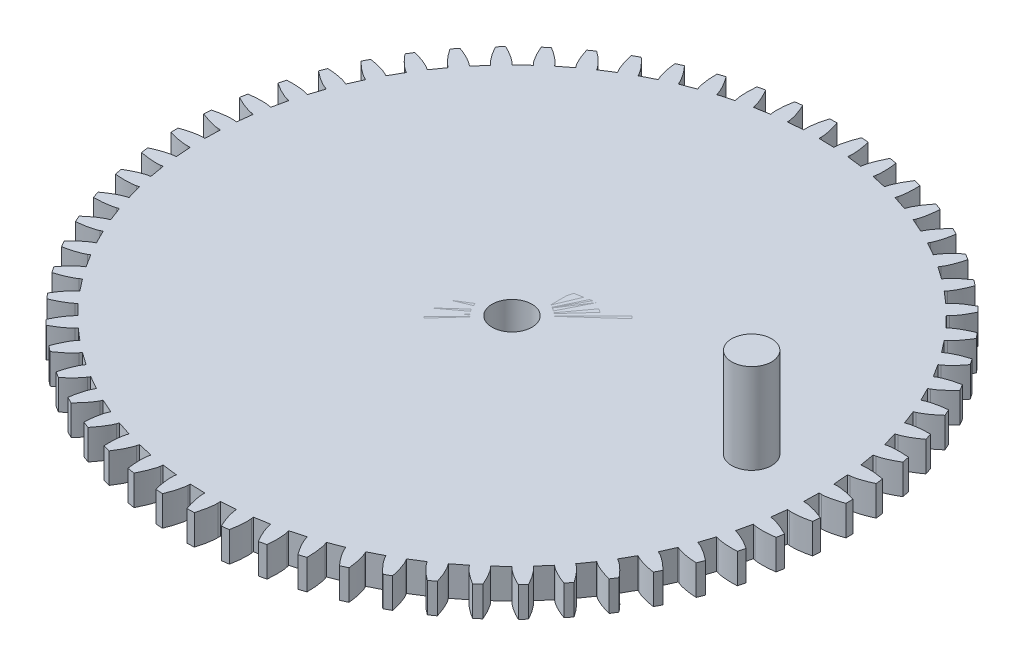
SolidWorks part; units mm, degrees
ref_plane "Front Plane" through (0, 0, 0) normal (0, 0, 1) x (1, 0, 0)
ref_plane "Top Plane" through (0, 0, 0) normal (0, 1, 0) x (1, 0, 0)
ref_plane "Right Plane" through (0, 0, 0) normal (1, 0, 0) x (0, 0, -1)
sketch "Sketch1" plane through (0, 0, 0) normal (0, 1, 0) x (1, 0, 0)
  line L0 (0, 0) -> (0, 15.4904) construction
  line L1 (0, 0) -> (-15.4904, 0) construction
  line L2 (0, 0) -> (-16.495, -0.4049) construction
  line L3 (0, 0) -> (-15.4717, -0.7601) construction
  line L4 (0, 0) -> (-15.4158, -1.5183) construction
  circle A0 centre (0, 0) radius 16 construction
  circle A1 centre (0, 0) radius 15.4904 construction
  circle A2 centre (0, 0) radius 15.375 construction
  circle A3 centre (0, 0) radius 16.5 construction
  spline S0 degree 4 poles (-15.4904, 0) (-15.5169, 0) (-15.5911, -0.0027) (-15.731, -0.0186) (-15.9571, -0.0597) (-16.2409, -0.1342) (-16.6008, -0.2552) (-17.0142, -0.4291) (-17.4552, -0.6523) (-17.9184, -0.9284) (-18.3641, -1.2326) (-18.7919, -1.5613) (-19.2022, -1.9118) (-19.6787, -2.3607) (-20.2209, -2.9349) (-20.8083, -3.6496) (-21.4174, -4.5168) (-21.9725, -5.443) (-22.4637, -6.4037) (-22.8391, -7.271) (-23.1228, -8.0279) (-23.3345, -8.6697) (-23.489, -9.1835) (-23.6643, -9.8404) (-23.8152, -10.487) (-23.9435, -11.1652) (-24.0686, -11.9401) (-24.1523, -12.6533) (-24.2099, -13.2503) (-24.2505, -14.0054) (-24.264, -14.391) (-24.2729, -14.9355) (-24.2689, -15.3393) (-24.2617, -15.7064) (-24.2528, -15.9118) (-24.2482, -16.0316) knots 0 0 0 0 0 0.005377 0.015084 0.028532 0.04661 0.064855 0.092111 0.119476 0.146842 0.174209 0.201575 0.228941 0.256307 0.307035 0.361767 0.4165 0.471232 0.525964 0.580697 0.608063 0.635429 0.662795 0.690161 0.744894 0.77226 0.799626 0.854358 0.881725 0.909091 0.931818 0.954545 0.977273 1 1 1 1 1 construction
  spline S1 degree 4 poles (-15.4904, 0) (-15.5169, 0) (-15.5911, -0.0027) (-15.731, -0.0186) (-15.9571, -0.0597) (-16.2409, -0.1342) (-16.6008, -0.2552) (-17.0142, -0.4291) (-17.4552, -0.6523) (-17.9184, -0.9284) (-18.3641, -1.2326) (-18.7919, -1.5613) (-19.2022, -1.9118) (-19.6787, -2.3607) (-20.2209, -2.9349) (-20.8083, -3.6496) (-21.4174, -4.5168) (-21.9725, -5.443) (-22.4637, -6.4037) (-22.8391, -7.271) (-23.1228, -8.0279) (-23.3345, -8.6697) (-23.489, -9.1835) (-23.6643, -9.8404) (-23.8152, -10.487) (-23.9435, -11.1652) (-24.0686, -11.9401) (-24.1523, -12.6533) (-24.2099, -13.2503) (-24.2435, -13.8756) (-24.2537, -14.1161) (-24.2578, -14.2386) knots 0 0 0 0 0 0.005377 0.015084 0.028532 0.04661 0.064855 0.092111 0.119476 0.146842 0.174209 0.201575 0.228941 0.256307 0.307035 0.361767 0.4165 0.471232 0.525964 0.580697 0.608063 0.635429 0.662795 0.690161 0.744894 0.77226 0.799626 0.854358 0.881725 0.909091 0.909091 0.909091 0.909091 0.909091
  dimension "D1" = 33
  dimension "D2" = 32
  dimension "D3" = 30.9807
  dimension "D4" = 30.75
  dimension "D5" = 15.4904
  dimension "D6" = 1.406
  dimension "D7" = 2.813
  dimension "D8" = 5.625
sketch "Sketch2" plane through (0, 0, 0) normal (0, 1, 0) x (1, 0, 0)
  line L0 (0, 0) -> (-16.495, -0.4049) construction
  line L1 (0, 0) -> (-16.495, -0.4049) construction
  line L2 (0, 0) -> (-15.4717, -0.7601) construction
  line L3 (0, 0) -> (-15.4904, 0) construction
  line L4 (0, 0) -> (-15.4158, -1.5183) construction
  line L5 (0, 0) -> (-15.4717, -0.7601) construction
  line L6 (0, 0) -> (-15.4904, 0) construction
  line L7 (0, 0) -> (-15.4158, -1.5183) construction
  line L8 (-15.4717, -0.7601) -> (-15.3565, -0.7544)
  line L9 (-15.3565, -0.7544) -> (-15.301, -1.507)
  line L10 (-15.301, -1.507) -> (-15.4158, -1.5183) construction
  line L11 (-15.301, -1.507) -> (-0.9952, -0.098)
  line L12 (-15.4904, 0) -> (-1, 0)
  circle A0 centre (0, 0) radius 15.375 construction
  circle A1 centre (0, 0) radius 15.4904 construction
  circle A2 centre (0, 0) radius 16 construction
  circle A3 centre (0, 0) radius 16.5 construction
  circle A4 centre (0, 0) radius 15.375 construction
  circle A5 centre (0, 0) radius 15.4904 construction
  circle A6 centre (0, 0) radius 16 construction
  circle A7 centre (0, 0) radius 16.5 construction
  arc A8 (-16.4896, -0.5857) -> (-16.4985, -0.2241) centre (0, 0) cw
  circle A11 centre (0, 0) radius 1 construction
  arc A12 (-1, 0) -> (-0.9952, -0.098) centre (0, 0) ccw
  spline S0 degree 4 poles (-74.7598, -1998.8887) (-11.1782, -43.2906) (-12.0624, -0.9289) (-14.0898, 0.2799) (-15.9571, -0.0597) (-16.2409, -0.1342) (-16.6008, -0.2552) (-17.0142, -0.4291) (-17.4552, -0.6523) (-17.9184, -0.9284) (-18.3641, -1.2326) (-18.7919, -1.5613) (-19.2022, -1.9118) (-19.6787, -2.3607) (-20.2209, -2.9349) (-20.8083, -3.6496) (-21.4174, -4.5168) (-21.9725, -5.443) (-22.4637, -6.4037) (-22.8391, -7.271) (-23.1228, -8.0279) (-23.3345, -8.6697) (-23.489, -9.1835) (-23.6643, -9.8404) (-23.8152, -10.487) (-23.9435, -11.1652) (-24.0686, -11.9401) (-24.1523, -12.6533) (-24.3829, -15.0417) (-24.3201, -20.6423) (-21.8513, 38.624) (-89.4077, -2013.0629) knots -0.338384 -0.338384 -0.338384 -0.338384 -0.338384 0.005377 0.015084 0.028532 0.04661 0.064855 0.092111 0.119476 0.146842 0.174209 0.201575 0.228941 0.256307 0.307035 0.361767 0.4165 0.471232 0.525964 0.580697 0.608063 0.635429 0.662795 0.690161 0.744894 0.77226 0.799626 0.854358 0.881725 1.319658 1.319658 1.319658 1.319658 1.319658 only from (-15.4904, 0) to (-24.2578, -14.2386) construction
  spline S1 degree 4 poles (-15.4904, 0) (-15.5169, 0) (-15.5911, -0.0027) (-15.731, -0.0186) (-15.9571, -0.0597) (-16.1824, -0.1188) (-16.3587, -0.1749) (-16.4707, -0.2141) (-16.4985, -0.2241) knots 0 0 0 0 0 0.005377 0.015084 0.028532 0.04661 0.05261 0.05261 0.05261 0.05261 0.05261
  spline S2 degree 4 poles (-15.4717, -0.7601) (-15.4982, -0.7614) (-15.5725, -0.7623) (-15.713, -0.7533) (-15.9408, -0.7233) (-16.1688, -0.6753) (-16.3476, -0.628) (-16.4613, -0.5943) (-16.4896, -0.5857) knots 0 0 0 0 0 0.005377 0.015084 0.028532 0.04661 0.05261 0.05261 0.05261 0.05261 0.05261
  point P21 (-15.3565, -0.7544)
  point P24 (-15.301, -1.507)
  dimension "D2" = 2
extrude "Boss-Extrude1" add sketch "Sketch2" along normal blind 1.5
pattern_circular "CirPattern1" count 64 over 360 of "Boss-Extrude1"
sketch "Sketch5" plane through (0, 1.5, 0) normal (0, 1, 0) x (1, 0, 0)
  line L0 (0, 0) -> (12, 0) construction
  circle A0 centre (12, 0) radius 1
  dimension "D1" = 2
  dimension "D2" = 12
extrude "Boss-Extrude2" add sketch "Sketch5" along normal blind 4.5 contours A0
equation "\"Module\"= .5"
equation "\"Number of Teeth\"= 64"
equation "\"Pressure Angle\"= 14.5deg"
equation "\"Pitch Diameter\"= \"Number of Teeth\" * \"Module\""
equation "\"Circular Pitch\"= pi * \"Module\""
equation "\"Addendum\"= \"Module\""
equation "\"Dedendum\"= 1.25 * \"Module\""
equation "\"Base Diameter\"= \"Pitch Diameter\" * cos ( \"Pressure Angle\" )"
equation "\"Base Radius\"= \"Base Diameter\" / 2"
equation "\"Width\"= 1.5"
equation "\"Outside Diameter\"= \"Pitch Diameter\" + 2 * \"Addendum\""
equation "\"D1@Sketch1\"=\"Outside Diameter\""
equation "\"D3@Sketch1\"=\"Base Diameter\""
equation "\"Root Diameter\"= \"Pitch Diameter\" - 2 * \"Dedendum\""
equation "\"D4@Sketch1\"=\"Root Diameter\""
equation "\"Tooth Angle\"= 360 / \"Number of Teeth\""
equation "\"D6@Sketch1\"=\"Tooth Angle\"/4"
equation "\"D7@Sketch1\"=\"Tooth Angle\"/2"
equation "\"D8@Sketch1\"=\"Tooth Angle\""
equation "\"D2@Sketch1\" = \"Pitch Diameter\""
equation "\"Shaft Diameter\"= 2"
equation "\"D1@CirPattern1\" = \"Number of Teeth\""
equation "\"D2@Sketch2\"= \"Shaft Diameter\""
equation "\"D1@Boss-Extrude1\" = \"Width\""
